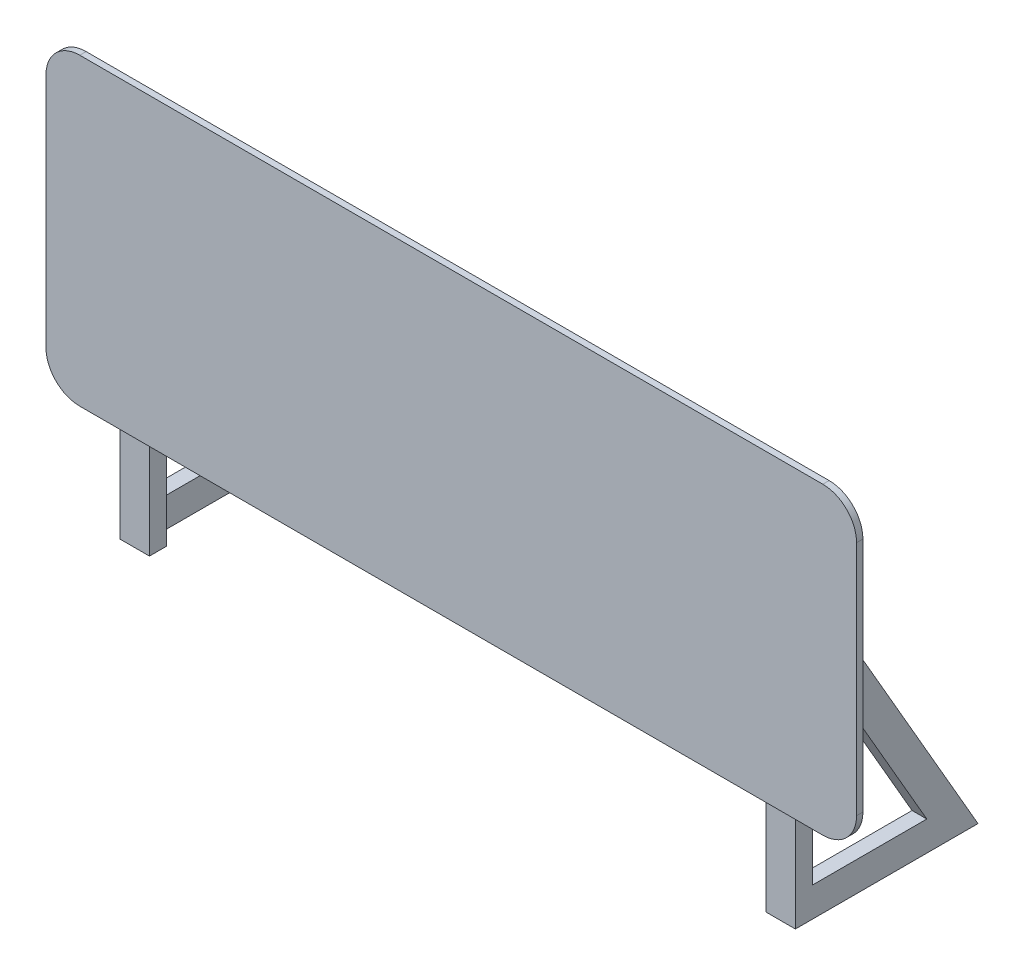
SolidWorks part; units mm, degrees
ref_plane "Front Plane" through (0, 0, 0) normal (0, 0, 1) x (1, 0, 0)
ref_plane "Top Plane" through (0, 0, 0) normal (0, 1, 0) x (1, 0, 0)
ref_plane "Right Plane" through (0, 0, 0) normal (1, 0, 0) x (0, 0, -1)
sketch "Sketch1" plane through (0, 0, 0) normal (0, 0, 1) x (1, 0, 0)
  line L1 (-1117.6, 914.4) -> (1117.6, 914.4)
  line L2 (-1219.2, 812.8) -> (-1219.2, 101.6)
  line L3 (-1117.6, 0) -> (1117.6, 0)
  line L4 (1219.2, 812.8) -> (1219.2, 101.6)
  arc A0 (1117.6, 914.4) -> (1219.2, 812.8) centre (1117.6, 812.8) cw
  arc A1 (-1117.6, 914.4) -> (-1219.2, 812.8) centre (-1117.6, 812.8) ccw
  arc A2 (-1219.2, 101.6) -> (-1117.6, 0) centre (-1117.6, 101.6) ccw
  arc A3 (1117.6, 0) -> (1219.2, 101.6) centre (1117.6, 101.6) ccw
  point P9 (-1219.2, 914.4)
  point P12 (-1219.2, 0)
  point P15 (1219.2, 0)
  dimension "D3" = 101.6
  dimension "D1" = 2438.4
  dimension "D2" = 914.4
extrude "Extrude1" add sketch "Sketch1" along normal blind 19.05
sketch "Sketch2" plane through (0, 0, 0) normal (0, 0, -1) x (-1, 0, 0)
  line L0 (1117.6, 0) -> (-1117.6, 0) construction
  line L1 (-1016, 762) -> (-927.1, 762)
  line L2 (-1016, 762) -> (-1016, -304.8)
  line L3 (-1016, -304.8) -> (-927.1, -304.8)
  line L4 (-927.1, 673.1) -> (-927.1, 241.3)
  line L5 (-1219.2, 101.6) -> (-1219.2, 812.8) construction
  line L6 (-1117.6, 914.4) -> (1117.6, 914.4) construction
  line L7 (-927.1, 152.4) -> (-927.1, -304.8)
  line L8 (-927.1, 762) -> (927.1, 762)
  line L9 (927.1, 152.4) -> (927.1, -304.8)
  line L10 (-927.1, 673.1) -> (927.1, 673.1)
  line L11 (927.1, -304.8) -> (1016, -304.8)
  line L13 (-927.1, 241.3) -> (927.1, 241.3)
  line L15 (-927.1, 152.4) -> (927.1, 152.4)
  line L16 (0, 914.4) -> (0, 1286.2332) construction
  line L17 (927.1, 673.1) -> (927.1, 241.3)
  line L18 (1016, 762) -> (1016, -304.8)
  line L19 (1016, 762) -> (927.1, 762)
  dimension "D1" = 88.9
  dimension "D2" = 203.2
  dimension "D3" = 1066.8
  dimension "D4" = 152.4
  dimension "D5" = 88.9
  dimension "D6" = 152.4
  dimension "D7" = 88.9
extrude "Extrude4" add sketch "Sketch2" along normal blind 50.8 separate body
sketch "Sketch4" plane through (-1016, 0, 0) normal (-1, 0, 0) x (0, 0, 1)
  line L0 (-50.8, 558.8) -> (-549.3997, -304.8)
  line L1 (-50.8, -304.8) -> (-50.8, 762) construction
  line L2 (-549.3997, -304.8) -> (-50.8, -304.8)
  line L3 (-50.8, 762) -> (0, 762) construction
  line L4 (-50.8, 381) -> (-395.4204, -215.9)
  line L5 (-395.4204, -215.9) -> (-50.8, -215.9)
  line L6 (-50.8, -304.8) -> (-50.8, -215.9)
  line L7 (26.1897, 514.35) -> (-395.4204, -215.9) construction
  line L8 (-50.8, 381) -> (-50.8, 558.8)
  dimension "D1" = 60
  dimension "D2" = 203.2
  dimension "D3" = 88.9
extrude "Extrude5" add sketch "Sketch4" against normal blind 44.45
mirror "Mirror3" about plane through (0, 0, 0) normal (1, 0, 0) of "Extrude5"
